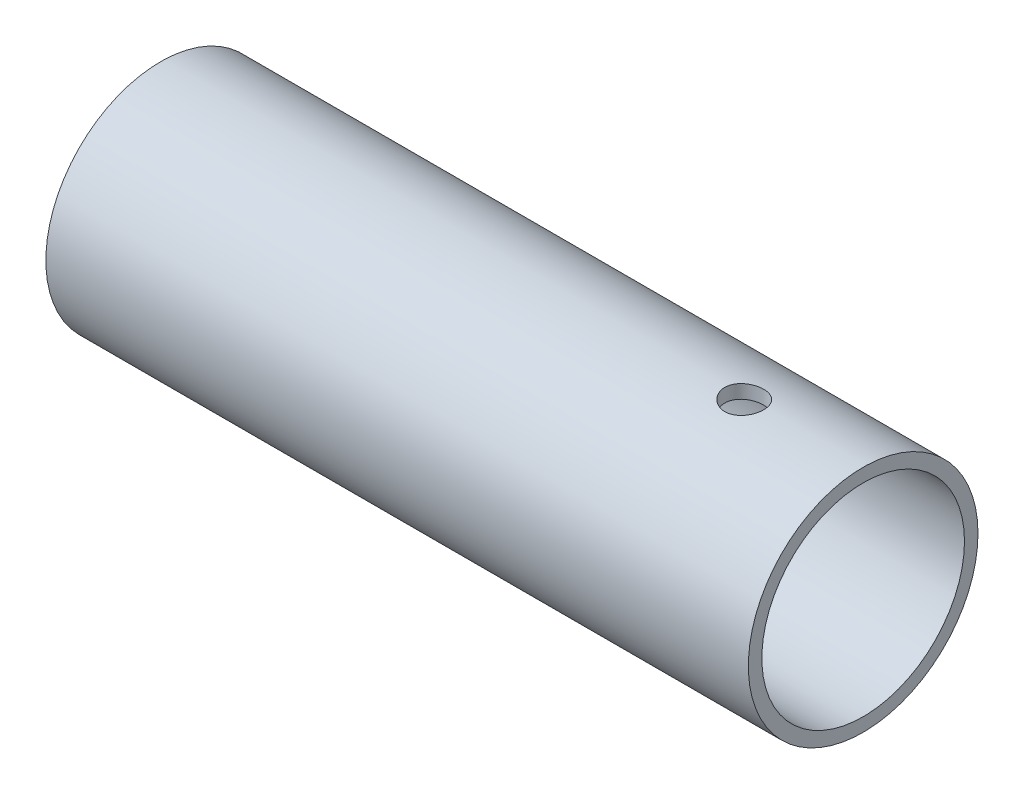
SolidWorks part; units mm, degrees
ref_plane "Front Plane" through (0, 0, 0) normal (0, 0, 1) x (1, 0, 0)
ref_plane "Top Plane" through (0, 0, 0) normal (0, 1, 0) x (1, 0, 0)
ref_plane "Right Plane" through (0, 0, 0) normal (1, 0, 0) x (0, 0, -1)
sketch "Sketch1" plane through (0, 0, 0) normal (1, 0, 0) x (0, 0, -1)
  circle A0 centre (0, 0) radius 53.975
  circle A1 centre (0, 0) radius 47.625
  dimension "D1" = 107.95
  dimension "D2" = 95.25
extrude "Boss-Extrude1" add sketch "Sketch1" along normal blind 330.2
sketch "Sketch2" plane through (0, 0, 0) normal (0, 1, 0) x (1, 0, 0)
  line L0 (0, 53.975) -> (0, -53.975) construction
  circle A0 centre (55.88, 0) radius 9.1281
  dimension "D1" = 18.2562
  dimension "D2" = 55.88
extrude "Cut-Extrude1" cut sketch "Sketch2" against normal blind 98.552
sketch "Sketch3" plane through (0, 0, 0) normal (0, 1, 0) x (1, 0, 0)
  line L0 (330.2, -53.975) -> (330.2, 53.975) construction
  circle A0 centre (274.32, 0) radius 9.1281
  dimension "D1" = 18.2562
  dimension "D2" = 55.88
extrude "Cut-Extrude2" cut sketch "Sketch3" along normal blind 136.906
